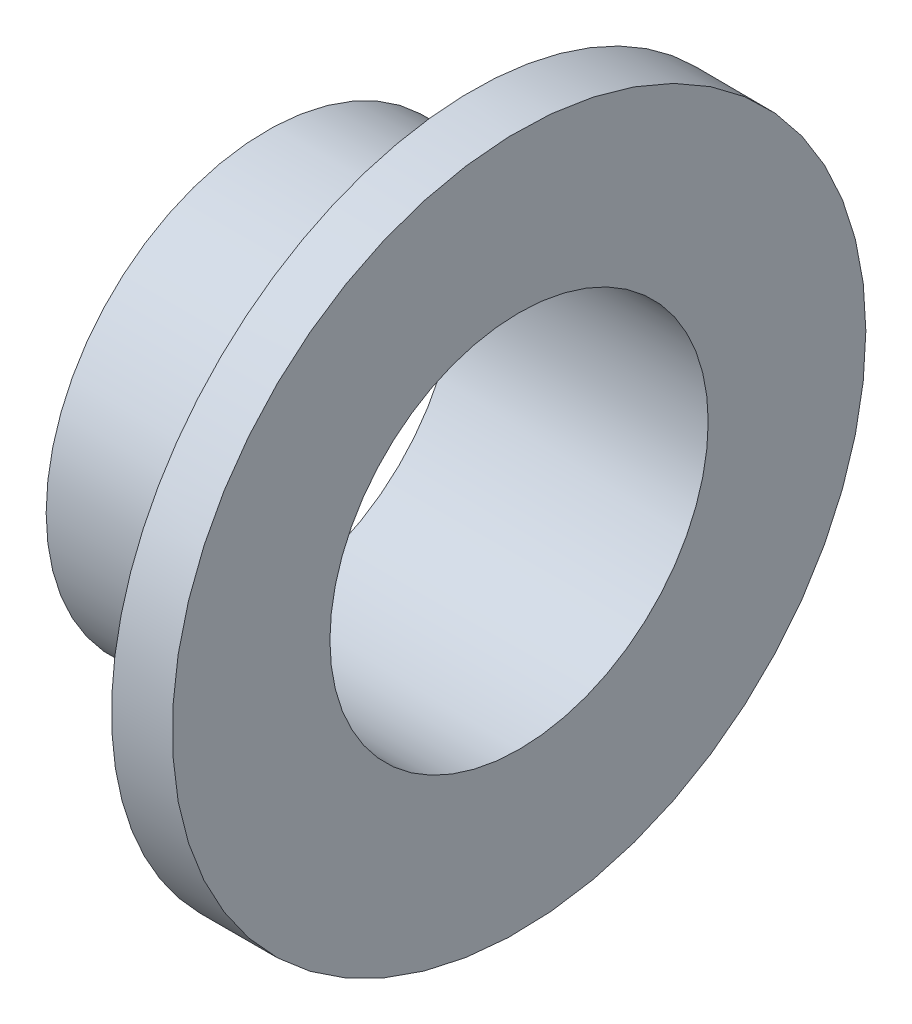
SolidWorks part; units mm, degrees
ref_plane "Plan de face" through (0, 0, 0) normal (0, 0, 1) x (1, 0, 0)
ref_plane "Plan de dessus" through (0, 0, 0) normal (0, 1, 0) x (1, 0, 0)
ref_plane "Plan de droite" through (0, 0, 0) normal (1, 0, 0) x (0, 0, -1)
sketch "Esquisse1" plane through (0, 0, 0) normal (0, 0, 1) x (1, 0, 0)
  line L0 (0, 0) -> (28.8225, 0) construction
  line L1 (16, 6) -> (-16, 6) construction
  line L2 (11.0091, 6) -> (17.0091, 6)
  line L3 (11.0091, 6) -> (11.0091, 7)
  line L4 (11.0091, 7) -> (17.0091, 7)
  line L5 (17.0091, 6) -> (17.0091, 7)
  dimension "D1" = 6
revolve "Révolution1" add sketch "Esquisse1" angle 360 about L0
ref_plane "Plan1" through (19.0091, 0, 0) normal (1, 0, 0) x (0, 0, -1)
sketch "Esquisse2" plane through (19.0091, 0, 0) normal (1, 0, 0) x (0, 0, -1)
  circle A0 centre (0, 0) radius 11
  circle A1 centre (0, 0) radius 11 construction
extrude "Extrusion1" add sketch "Esquisse2" along normal up to surface (2.6483 mm away)
sketch "Esquisse3" plane through (11.0091, 0, 0) normal (-1, 0, 0) x (0, 0, 1)
  circle A0 centre (0, 0) radius 6
  circle A1 centre (0, 0) radius 6 construction
extrude "Extrusion2" cut sketch "Esquisse3" against normal up to next
sketch "Esquisse4" plane through (19.0091, 0, 0) normal (1, 0, 0) x (0, 0, -1)
  arc A0 (-6.8669, 1.3583) -> (0, 7) centre (0, 0) ccw construction
  arc A1 (-6.8669, 1.3583) -> (0, 7) centre (0, 0) ccw
  arc A2 (0, 7) -> (-6.8669, 1.3583) centre (0, 0) ccw construction
  arc A3 (0, 7) -> (-6.8669, 1.3583) centre (0, 0) ccw
  circle A4 centre (0, 0) radius 6 construction
  circle A5 centre (0, 0) radius 6
extrude "Extrusion3" add sketch "Esquisse4" against normal up to surface (8 mm away)
